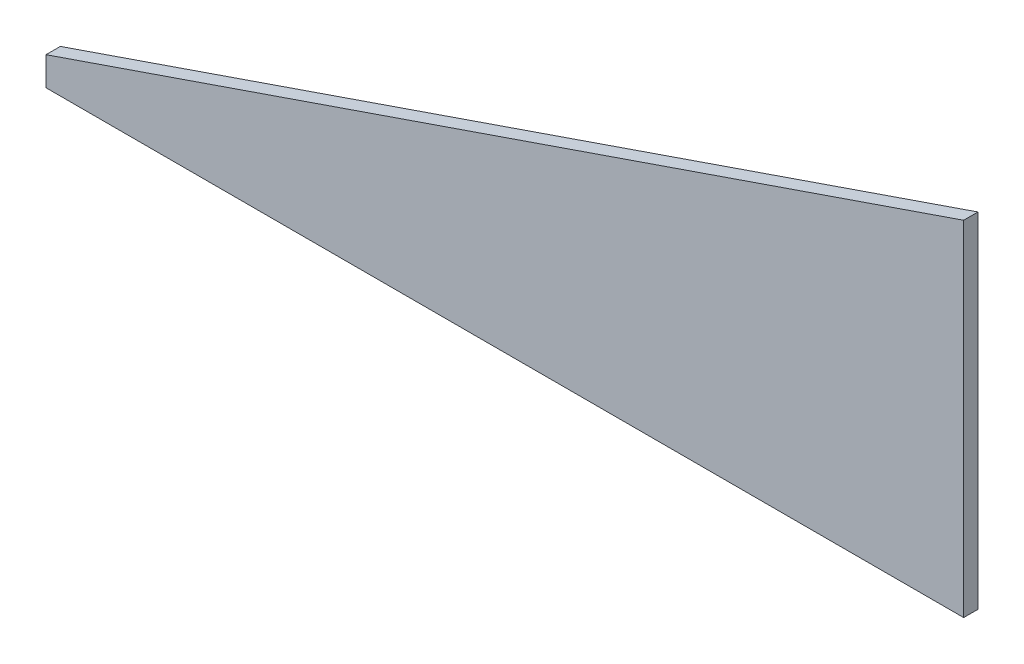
SolidWorks part; units mm, degrees
ref_plane "Plan de face" through (0, 0, 0) normal (0, 0, 1) x (1, 0, 0)
ref_plane "Plan de dessus" through (0, 0, 0) normal (0, 1, 0) x (1, 0, 0)
ref_plane "Plan de droite" through (0, 0, 0) normal (1, 0, 0) x (0, 0, -1)
sketch "Esquisse1" plane through (0, 0, 0) normal (0, 0, 1) x (1, 0, 0)
  line L0 (0, 0) -> (160, 0)
  line L1 (160, 0) -> (160, 60)
  line L2 (0, 0) -> (0, 5)
  line L3 (0, 5) -> (160, 60)
  dimension "D1" = 160
  dimension "D2" = 60
  dimension "D3" = 5
sheet metal parameters "Tôlerie 1" thickness 2.5 parameters "D1"=2.5
base flange "Tôle de base pliée1" sketch "Esquisse1" thickness 2.5 reverse thickness direction yes parameters "D1"=2.5
flat pattern "Etat déplié1"
sketch "Lignes de pliage1" plane through (0, 0, 0) normal (0, 1, 0) x (-1, 0, 0)
